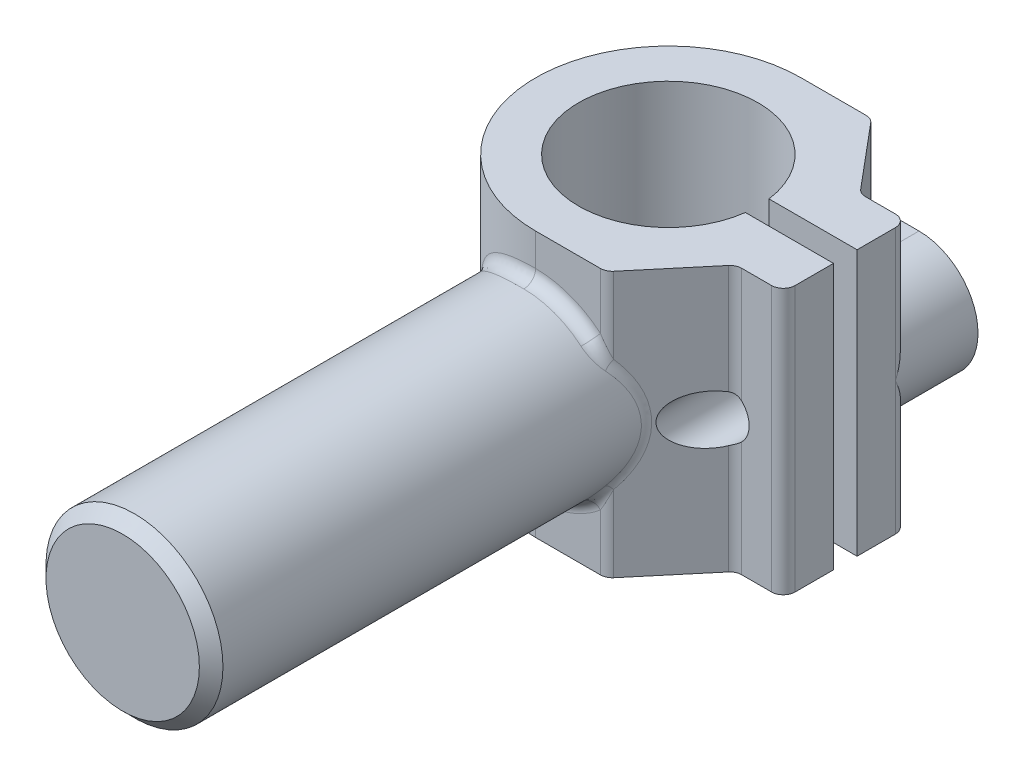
SolidWorks part; units mm, degrees
ref_plane "Front Plane" through (0, 0, 0) normal (0, 0, 1) x (1, 0, 0)
ref_plane "Top Plane" through (0, 0, 0) normal (0, 1, 0) x (1, 0, 0)
ref_plane "Right Plane" through (0, 0, 0) normal (1, 0, 0) x (0, 0, -1)
other "Configuration Table"
sketch "Sketch1" plane through (0, 0, 0) normal (0, 1, 0) x (1, 0, 0)
  line L0 (7.5339, 1) -> (15, 1)
  line L1 (0, 11.25) -> (15, 11.25)
  line L2 (7.5339, -1) -> (15, -1)
  line L3 (0, -11.25) -> (15, -11.25)
  line L4 (15, 11.25) -> (15, 1)
  line L5 (15, -1) -> (15, -11.25)
  arc A0 (7.5339, 1) -> (7.5339, -1) centre (0, 0) ccw
  arc A1 (0, 11.25) -> (0, -11.25) centre (0, 0) ccw
  dimension "D3" = 15.2
  dimension "D1" = 22.5
  dimension "D2" = 15
  dimension "D4" = 2
extrude "Extrude1" add sketch "Sketch1" along normal mid plane 22.5
sketch "Sketch4" plane through (0, 11.25, 0) normal (0, -1, 0) x (1, 0, 0)
  line L0 (15, -1) -> (15, -11.25) construction
  line L2 (5.9654, 11.25) -> (11, 5.25)
  line L3 (11, 5.25) -> (15, 5.25)
  line L5 (15, 11.25) -> (15, 5.25)
  line L7 (0, 11.25) -> (15, 11.25) construction
  line L8 (5.9654, 11.25) -> (15, 11.25)
  dimension "D1" = 4
  dimension "D2" = 130
  dimension "D3" = 6
extrude "Cut-Extrude3" cut sketch "Sketch4" along normal through all
mirror "Mirror1" about plane through (0, 0, 0) normal (0, 0, 1) of "Cut-Extrude3"
fillet "Fillet4" radius 1 6 edges at (11, 0, 5.25) (15, 0, -5.25) (11, 0, -5.25) (5.9654, 0, 11.25) (5.9654, 0, -11.25) (15, 0, 5.25)
sketch "Sketch6" plane through (0, 0, -11.25) normal (0, 0, 1) x (-1, 0, 0)
  line L0 (-15, 11.25) -> (-15, -11.25) construction
  line L1 (-10, -5) -> (0, -5)
  line L2 (0, -5) -> (0, 5)
  line L3 (0, 5) -> (-10, 5)
  arc A0 (-10, 5) -> (-10, -5) centre (-10, 0) ccw
  dimension "D1" = 5
extrude "Extrude2" add sketch "Sketch6" along normal up to next
sketch "Sketch7" plane through (0, 0, 11.25) normal (0, 0, 1) x (1, 0, 0)
  circle A0 centre (0, 0) radius 7.5
  dimension "D1" = 15
extrude "Extrude3" add sketch "Sketch7" along normal blind 35 and the other way up to next
fillet "Fillet7" radius 1 6 edges at (5.932, -4.5893, 11.1514) (5.1264, 5.4745, 9.3221) (3, 6.8739, 11.25) (3, -6.8739, 11.25) (-7.4891, 0.4045, 8.395) (7.5, 0, 9.4211)
chamfer "Chamfer1" distance 1 angle 45 1 edges at (7.5, 0, 46.25)
hole_wizard "M5 Clearance Hole1" positions "Sketch9" profile "Sketch8" hole size "M5" standard "Ansi Metric"
sketch "Sketch9" plane through (0, 0, -11.25) normal (0, 0, -1) x (-1, 0, 0)
  arc A0 (-10, 5) -> (-10, -5) centre (-10, 0) ccw construction
  point P0 (-10, 0)
sketch "Sketch8" plane through (10, 0, -11.25) normal (1, 0, 0) x (0, 1, 0)
  line L0 (0, 0) -> (0, 10.25)
  line L1 (0, 10.25) -> (2.75, 10.25)
  line L2 (2.75, 10.25) -> (2.75, 0)
  line L5 (2.75, 0) -> (0, 0)
  line L11 (0, -6.35) -> (0, 107.95) construction
  dimension "Thru Hole Dia." = 5.5
  dimension "Thru Hole Depth" = 10.25
hole_wizard "M5x0.8 Tapped Hole1" positions "Sketch11" profile "Sketch10" tap size "M5x0.8" standard "Ansi Metric"
sketch "Sketch11" plane through (0, 0, 1) normal (0, 0, -1) x (-1, 0, 0)
  point P1 (-10, 0)
sketch "Sketch10" plane through (10, 0, 1) normal (1, 0, 0) x (0, 1, 0)
  line L0 (0, 0) -> (0, 13.6618)
  line L1 (0, 13.6618) -> (2.1, 12.4)
  line L2 (2.1, 12.4) -> (2.1, 0)
  line L5 (2.1, 0) -> (0, 0)
  line L10 (0, 13.6618) -> (-2.1, 12.4) construction
  line L11 (0, -6.35) -> (0, 107.95) construction
  dimension "Tap Drill Dia." = 4.2
  dimension "Tap Drill Depth" = 12.4
  dimension "Drill Angle" = 118
